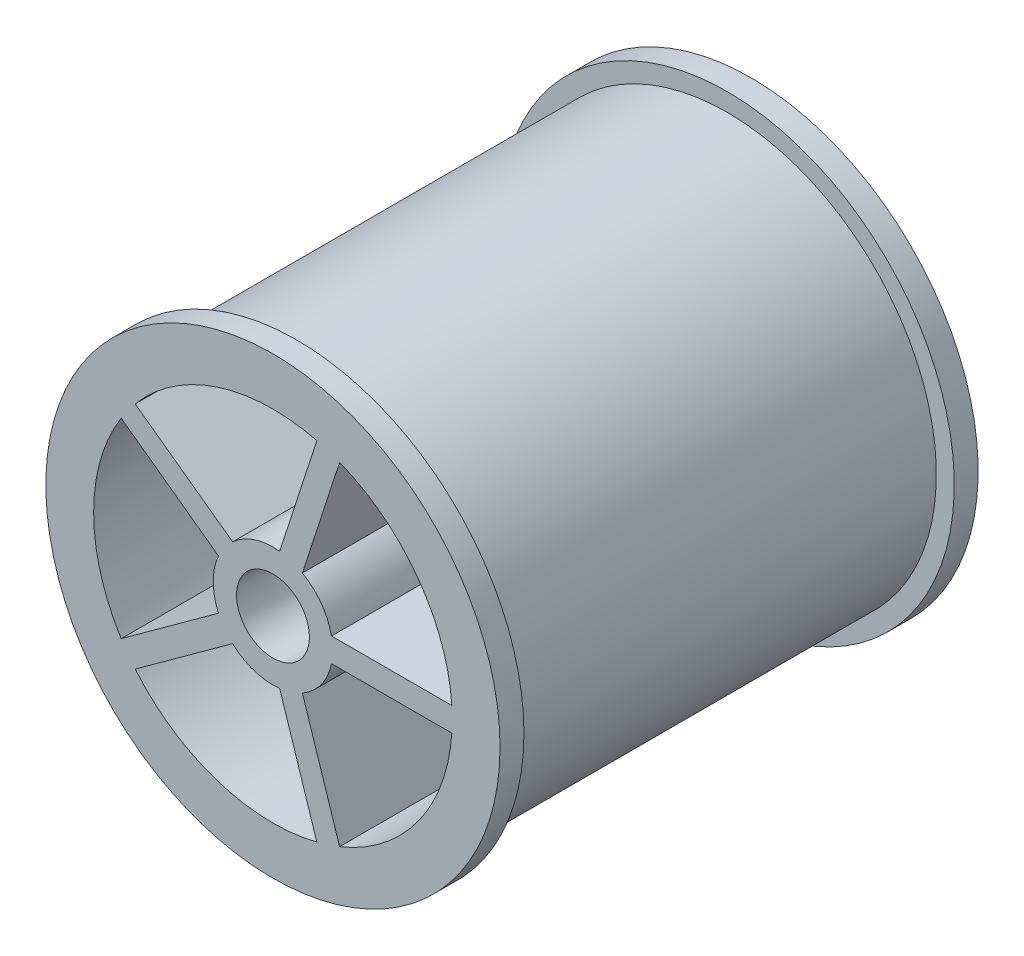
SolidWorks part; units mm, degrees
ref_plane "Plan de face" through (0, 0, 0) normal (0, 0, 1) x (1, 0, 0)
ref_plane "Plan de dessus" through (0, 0, 0) normal (0, 1, 0) x (1, 0, 0)
ref_plane "Plan de droite" through (0, 0, 0) normal (1, 0, 0) x (0, 0, -1)
sketch "Esquisse1" plane through (0, 0, 0) normal (0, 0, 1) x (1, 0, 0)
  circle A0 centre (0, 0) radius 17.5
  dimension "D1" = 35
extrude "Boss.-Extru.1" add sketch "Esquisse1" along normal blind 40
sketch "Esquisse2" plane through (0, 0, 40) normal (0, 0, 1) x (1, 0, 0)
  circle A0 centre (0, 0) radius 19
  dimension "D1" = 38
extrude "Boss.-Extru.2" add sketch "Esquisse2" against normal blind 2
sketch "Esquisse3" plane through (0, 0, 0) normal (0, 0, -1) x (-1, 0, 0)
  circle A0 centre (0, 0) radius 19
  dimension "D1" = 38
extrude "Boss.-Extru.3" add sketch "Esquisse3" against normal blind 2
sketch "Esquisse4" plane through (0, 0, 0) normal (0, 0, -1) x (-1, 0, 0)
  line L2 (-1.55, 2.0248) -> (-1.55, -2.0248)
  line L4 (1.55, 2.0248) -> (1.55, -2.0248)
  line L5 (-1.6, 3.0036) -> (1.5569, -2.9227) construction
  line L6 (-1.5, -3.0036) -> (1.5, 3.0036) construction
  arc A0 (1.55, 2.0248) -> (-1.55, 2.0248) centre (0, 0) ccw
  arc A1 (-1.55, -2.0248) -> (1.55, -2.0248) centre (0, 0) ccw
  dimension "D1" = 5.1
  dimension "D2" = 1.55
  dimension "D3" = 3.1
extrude "Enlèv. mat.-Extru.1" cut sketch "Esquisse4" against normal blind 5
shell "Coque1" thickness 2.5
sketch "Esquisse5" plane through (0, 0, 7.5) normal (0, 0, 1) x (1, 0, 0)
  line L0 (1.55, 2.0248) -> (1.55, -2.0248) construction
  line L1 (-1.55, -2.0248) -> (-1.55, 2.0248) construction
  line L2 (1.55, 2.0248) -> (1.55, -2.0248)
  line L3 (-1.55, -2.0248) -> (-1.55, 2.0248)
  circle A0 centre (0, 0) radius 5
  arc A1 (-1.55, -2.0248) -> (1.55, -2.0248) centre (0, 0) ccw construction
  arc A2 (1.55, 2.0248) -> (-1.55, 2.0248) centre (0, 0) ccw construction
  arc A3 (-1.55, -2.0248) -> (1.55, -2.0248) centre (0, 0) ccw
  arc A4 (1.55, 2.0248) -> (-1.55, 2.0248) centre (0, 0) ccw
  dimension "D1" = 10
extrude "Boss.-Extru.4" add sketch "Esquisse5" against normal up to surface and the other way up to surface
fillet "Congé1" radius 4 2 edges at (-5, 0, 2.5) (15, 0, 2.5)
sketch "Esquisse6" plane through (0, 0, 40) normal (0, 0, 1) x (1, 0, 0)
  circle A0 centre (0, 0) radius 3.05
  dimension "D1" = 6.1
extrude "Enlèv. mat.-Extru.3" cut sketch "Esquisse6" against normal blind 30
sketch "Esquisse7" plane through (0, 0, 40) normal (0, 0, 1) x (1, 0, 0)
  line L0 (5, 0) -> (15, 0) construction
  line L2 (15.9108, 1) -> (4.0892, 1)
  line L3 (15.9108, 1) -> (15.9108, -1)
  line L4 (15.9108, -1) -> (4.0892, -1)
  line L5 (4.0892, 1) -> (4.0892, -1)
  line L6 (15.9108, 1) -> (4.0892, -1) construction
  line L7 (15.9108, -1) -> (4.0892, 1) construction
  arc A0 (4.05, -2.9321) -> (4.05, 2.9321) centre (0, 0) ccw construction
  circle A1 centre (0, 0) radius 15 construction
  point P8 (10, 0)
  dimension "D1" = 11.8216
  dimension "D2" = 2
extrude "Boss.-Extru.5" add sketch "Esquisse7" against normal up to next
pattern_circular "Répétition circulaire1" count 5 over 360 about axis through (0, 0, 0) along (0, 0, 1) of "Boss.-Extru.5"
sketch "Esquisse8" plane through (0, 0, 0) normal (0, 0, -1) x (-1, 0, 0)
  line L0 (-1.55, 2.0248) -> (-1.55, -2.0248) construction
  line L1 (1.55, -2.0248) -> (1.55, 2.0248) construction
  line L2 (-1.55, 2.0248) -> (-1.55, -2.0248)
  line L3 (1.55, -2.0248) -> (1.55, 2.0248)
  arc A0 (-1.55, -2.0248) -> (1.55, -2.0248) centre (0, 0) ccw construction
  arc A1 (1.55, 2.0248) -> (-1.55, 2.0248) centre (0, 0) ccw construction
  arc A2 (-1.55, -2.0248) -> (1.55, -2.0248) centre (0, 0) ccw
  arc A3 (1.55, 2.0248) -> (-1.55, 2.0248) centre (0, 0) ccw
  circle A4 centre (0, 0) radius 4.3
  dimension "D1" = 8.6
extrude "Boss.-Extru.6" add sketch "Esquisse8" along normal blind 4
fillet "Congé2" radius 2 1 edges at (4.3, 0, 0)
